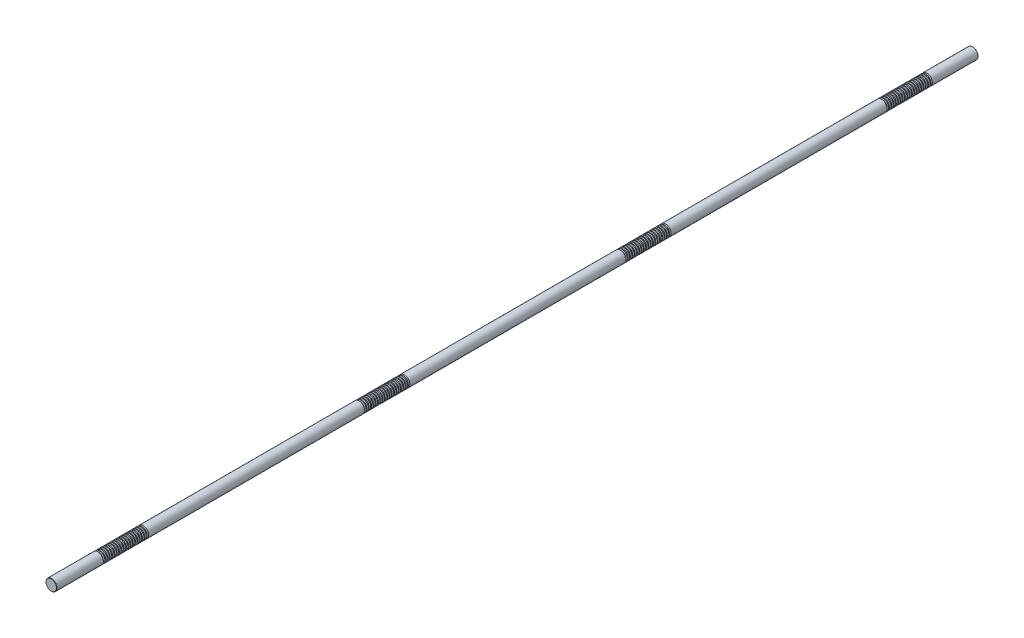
SolidWorks part; units mm, degrees
ref_plane "Front Plane" through (0, 0, 0) normal (0, 0, 1) x (1, 0, 0)
ref_plane "Top Plane" through (0, 0, 0) normal (0, 1, 0) x (1, 0, 0)
ref_plane "Right Plane" through (0, 0, 0) normal (1, 0, 0) x (0, 0, -1)
sketch "Sketch1" plane through (0, 0, 0) normal (0, 0, 1) x (1, 0, 0)
  circle A0 centre (0, 0) radius 12
  dimension "D1" = 24
extrude "Boss-Extrude1" add sketch "Sketch1" along normal mid plane 2000
chamfer "Chamfer1" distance 0.6 angle 45 2 edges at (12, 0, -1000) (12, 0, 1000)
sketch "Sketch2" plane through (0, 0, 0) normal (1, 0, 0) x (0, 0, -1)
  line L0 (900.3684, 12) -> (897.1316, 12)
  line L1 (999.4, 12) -> (-999.4, 12) construction
  line L2 (897.1316, 12) -> (897.8684, 9.25)
  line L3 (897.8684, 9.25) -> (899.6316, 9.25)
  line L4 (899.6316, 9.25) -> (900.3684, 12)
  line L5 (1000, -11.4) -> (1000, 11.4) construction
  point P4 (898.75, 12)
  point P7 (898.75, 9.25)
  point P8 (900, 10.625)
  point P9 (897.5, 10.625)
  dimension "D1" = 2.5
  dimension "D2" = 100
  dimension "D3" = 2.75
  dimension "D4" = 30
revolve "Cut-Revolve1" cut sketch "Sketch2" angle 360 about axis through (0, 0, 1000) along (0, 0, -1)
pattern_linear "LPattern1" count 20 spacing 5 along (0, 0, 1) of "Cut-Revolve1"
pattern_linear "LPattern2" count 4 spacing 567 along (0, 0, 1) of "Cut-Revolve1", "LPattern1"
